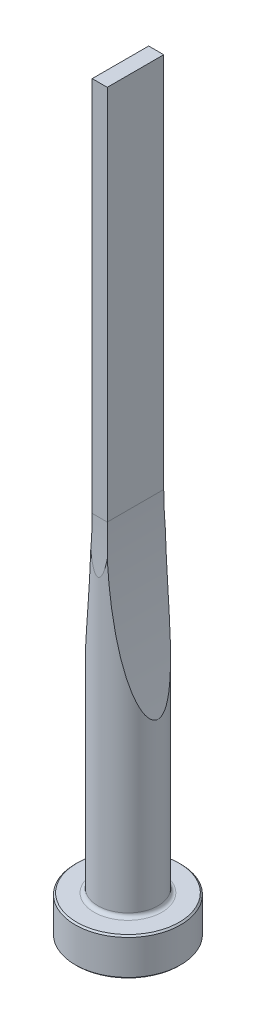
SolidWorks part; units mm, degrees
ref_plane "Front Plane" through (0, 0, 0) normal (0, 0, 1) x (1, 0, 0)
ref_plane "Top Plane" through (0, 0, 0) normal (0, 1, 0) x (1, 0, 0)
ref_plane "Right Plane" through (0, 0, 0) normal (1, 0, 0) x (0, 0, -1)
sketch "Sketch1" plane through (0, 0, 0) normal (0, 0, 1) x (1, 0, 0)
  line L0 (0, 0) -> (6.8, 0)
  line L1 (55, 0) -> (-55, 0) construction
  line L2 (7, 0.2) -> (7, 4.8)
  line L3 (6.8, 5) -> (4.5, 5)
  line L4 (4, 5.5) -> (4, 100)
  line L5 (0, 100) -> (4, 100)
  line L6 (7, 4.8) -> (6.8, 5)
  line L7 (6.8, 0) -> (7, 0.2)
  line L8 (0, 100) -> (0, 0)
  arc A0 (4, 5.5) -> (4.5, 5) centre (4.5, 5.5) ccw
  point P1 (7, 0)
  point P6 (7, 5)
  dimension "D4" = 0.5
  dimension "D1" = 4
  dimension "D2" = 7
  dimension "D3" = 5
  dimension "D5" = 100
revolve "Revolve1" add sketch "Sketch1" angle 360 about L8
sketch "Sketch2" plane through (0, 0, 0) normal (0, 0, 1) x (1, 0, 0)
  line L0 (1, 100) -> (1, 50)
  line L1 (4, 100) -> (-4, 100) construction
  line L2 (-1, 100) -> (-1, 50)
  line L3 (4, 100) -> (4, 26.9566)
  line L4 (-4, 100) -> (-4, 26.9566)
  line L5 (0, -7.7) -> (0, 7.7) construction
  line L6 (4, 100) -> (1, 100)
  line L8 (-1, 100) -> (-4, 100)
  arc A0 (1, 50) -> (4, 26.9566) centre (91, 50) ccw
  arc A1 (-1, 50) -> (-4, 26.9566) centre (-91, 50) cw
  dimension "D4" = 90
  dimension "D1" = 50
  dimension "D2" = 2
  dimension "D3" = 1
extrude "Cut-Extrude1" cut sketch "Sketch2" against normal mid plane 10
sketch "Sketch3" plane through (0, 0, 0) normal (1, 0, 0) x (0, 0, -1)
  line L0 (3.75, 100) -> (3.75, 50)
  line L1 (-3.873, 100) -> (3.873, 100) construction
  line L2 (-3.75, 100) -> (-3.75, 50)
  line L3 (4, 100) -> (4, 43.2965)
  line L4 (3.75, 100) -> (4, 100)
  line L5 (0, 7.7) -> (0, -7.7) construction
  line L6 (-4, 100) -> (-4, 43.2965)
  line L8 (-3.75, 100) -> (-4, 100)
  arc A0 (3.75, 50) -> (4, 43.2965) centre (93.75, 50) ccw
  arc A1 (-3.75, 50) -> (-4, 43.2965) centre (-93.75, 50) cw
  dimension "D2" = 90
  dimension "D1" = 50
  dimension "D3" = 7.5
  dimension "D4" = 3.75
extrude "Cut-Extrude2" cut sketch "Sketch3" against normal mid plane 10
